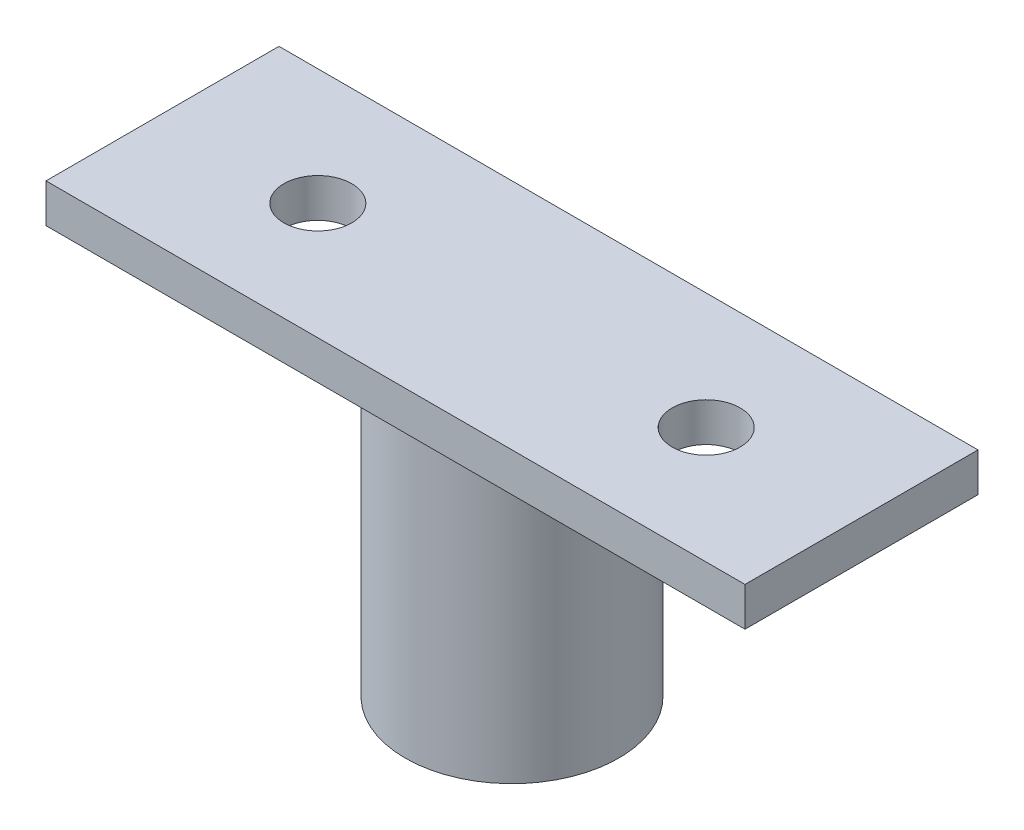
SolidWorks part; units mm, degrees
ref_plane "Front Plane" through (0, 0, 0) normal (0, 0, 1) x (1, 0, 0)
ref_plane "Top Plane" through (0, 0, 0) normal (0, 1, 0) x (1, 0, 0)
ref_plane "Right Plane" through (0, 0, 0) normal (1, 0, 0) x (0, 0, -1)
sketch "Sketch1" plane through (0, 0, 0) normal (0, 1, 0) x (1, 0, 0)
  circle A0 centre (0, 0) radius 4
  circle A1 centre (0, 0) radius 5.5
  dimension "D1" = 8
  dimension "D2" = 11
extrude "Boss-Extrude1" add sketch "Sketch1" along normal blind 15
sketch "Sketch2" plane through (0, 15, 0) normal (0, 1, 0) x (1, 0, 0)
  line L1 (-18, 6) -> (18, 6)
  line L2 (-18, 6) -> (-18, -6)
  line L3 (-18, -6) -> (18, -6)
  line L4 (18, 6) -> (18, -6)
  dimension "D1" = 6
  dimension "D2" = 6
  dimension "D3" = 18
  dimension "D4" = 18
extrude "Boss-Extrude2" add sketch "Sketch2" along normal blind 2
sketch "Sketch3" plane through (0, 17, 0) normal (0, 1, 0) x (1, 0, 0)
  line L0 (18, 6) -> (-18, 6) construction
  circle A0 centre (-10, 0) radius 1.75
  circle A1 centre (10, 0) radius 1.75
  dimension "D1" = 3.5
  dimension "D2" = 3.5
  dimension "D3" = 20
  dimension "D4" = 10
  dimension "D5" = 6
extrude "Cut-Extrude1" cut sketch "Sketch3" against normal blind 2
